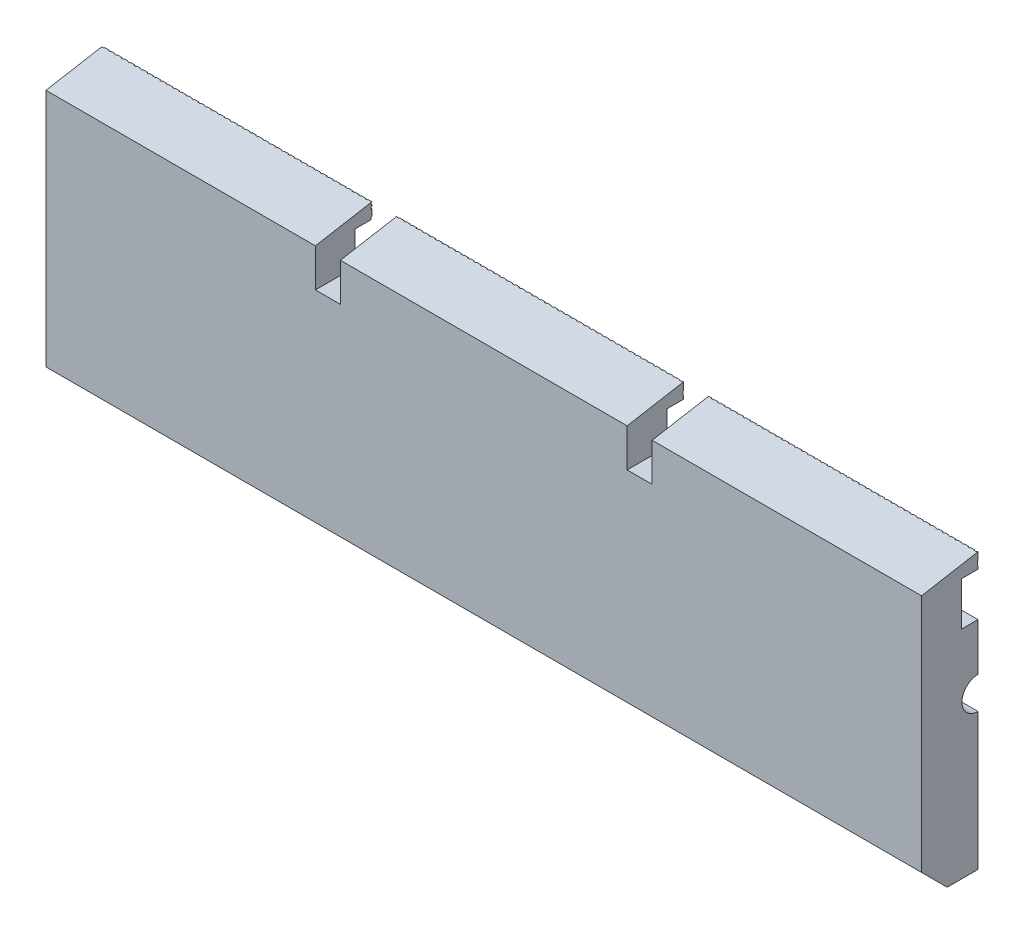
SolidWorks part; units mm, degrees
ref_plane "Plan de face" through (0, 0, 0) normal (0, 0, 1) x (1, 0, 0)
ref_plane "Plan de dessus" through (0, 0, 0) normal (0, 1, 0) x (1, 0, 0)
ref_plane "Plan de droite" through (0, 0, 0) normal (1, 0, 0) x (0, 0, -1)
imported_body "Importée1"
sketch "Esquisse1" plane through (-68.25, 0, 0) normal (-1, 0, 0) x (0, 0, 1)
  line L1 (0, 19.9908) -> (2.6, 19.9908)
  line L2 (0, 19.9908) -> (0, 13.1908)
  line L3 (0, 13.1908) -> (2.6, 13.1908)
  line L4 (2.6, 19.9908) -> (2.6, 13.1908)
  dimension "D1" = 2.6
  dimension "D2" = 6.8
extrude "rainure prismatique" cut sketch "Esquisse1" against normal through all
sketch "Esquisse2" plane through (-68.25, 0, 0) normal (-1, 0, 0) x (0, 0, 1)
  line L0 (0, 13.1908) -> (0, -20.55) construction
  line L1 (0, 0.7908) -> (0, 5.7908)
  arc A0 (0, 5.7908) -> (0, 0.7908) centre (0, 3.2908) cw
  dimension "D1" = 7.4
  dimension "D2" = 2.5
extrude "rainure cylindrique" cut sketch "Esquisse2" against normal through all
